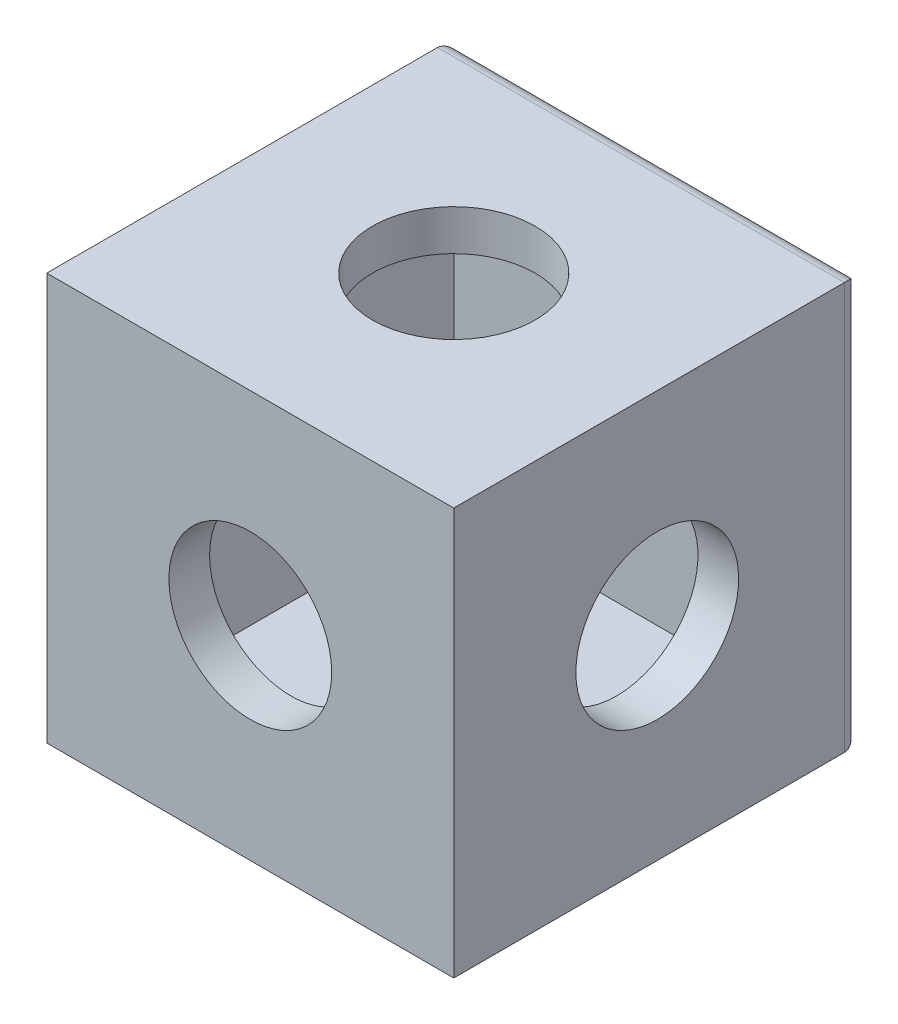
SolidWorks part; units mm, degrees
ref_plane "Alzado" through (0, 0, 0) normal (0, 0, 1) x (1, 0, 0)
ref_plane "Planta" through (0, 0, 0) normal (0, 1, 0) x (1, 0, 0)
ref_plane "Vista lateral" through (0, 0, 0) normal (1, 0, 0) x (0, 0, -1)
sketch "Croquis1" plane through (0, 0, 0) normal (0, 0, 1) x (1, 0, 0)
  line L1 (-62.5, 62.5) -> (62.5, 62.5)
  line L2 (-62.5, 62.5) -> (-62.5, -62.5)
  line L3 (-62.5, -62.5) -> (62.5, -62.5)
  line L4 (62.5, 62.5) -> (62.5, -62.5)
  line L5 (-62.5, 62.5) -> (62.5, -62.5) construction
  line L6 (-62.5, -62.5) -> (62.5, 62.5) construction
  line L7 (-50, 50) -> (50, 50)
  line L8 (-50, 50) -> (-50, -50)
  line L9 (-50, -50) -> (50, -50)
  line L10 (50, 50) -> (50, -50)
  line L11 (-50, 50) -> (50, -50) construction
  line L12 (-50, -50) -> (50, 50) construction
  point P0 (0, 0)
  point P6 (0, 0)
  dimension "D1" = 125
  dimension "D2" = 125
  dimension "D3" = 100
extrude "Saliente-Extruir1" add sketch "Croquis1" along normal blind 125
sketch "Croquis2" plane through (0, 0, 0) normal (0, 0, -1) x (-1, 0, 0)
  line L1 (-50, 50) -> (50, 50)
  line L2 (-50, 50) -> (-50, -50)
  line L3 (-50, -50) -> (50, -50)
  line L4 (50, 50) -> (50, -50)
  line L5 (-50, 50) -> (50, -50) construction
  line L6 (-50, -50) -> (50, 50) construction
  point P0 (0, 0)
extrude "Saliente-Extruir2" add sketch "Croquis2" against normal blind 12.5
sketch "Croquis3" plane through (-62.5, 0, 0) normal (-1, 0, 0) x (0, 0, 1)
  line L0 (0, 62.5) -> (0, -62.5) construction
  line L1 (125, 62.5) -> (0, 62.5) construction
  circle A0 centre (62.5, 0) radius 25
  dimension "D1" = 62.5
  dimension "D2" = 62.5
extrude "Cortar-Extruir1" cut sketch "Croquis3" against normal blind 187.5
sketch "Croquis4" plane through (0, 62.5, 0) normal (0, 1, 0) x (1, 0, 0)
  line L0 (62.5, -125) -> (62.5, 0) construction
  line L1 (62.5, 0) -> (-62.5, 0) construction
  circle A0 centre (0, -62.5) radius 25
  dimension "D1" = 50
  dimension "D2" = 62.5
  dimension "D3" = 62.5
extrude "Cortar-Extruir2" cut sketch "Croquis4" against normal blind 187.5
ref_plane "Plano1" through (62.5, -62.5, 125) normal (1, 0, 0) x (0, 0, -1)
sketch "Croquis6" plane through (0, 0, 125) normal (0, 0, 1) x (1, 0, 0)
  line L1 (-50, 50) -> (50, 50)
  line L2 (-50, 50) -> (-50, -50)
  line L3 (-50, -50) -> (50, -50)
  line L4 (50, 50) -> (50, -50)
  line L5 (-50, 50) -> (50, -50) construction
  line L6 (-50, -50) -> (50, 50) construction
  point P0 (0, 0)
extrude "Saliente-Extruir3" add sketch "Croquis6" against normal blind 12.5
sketch "Croquis7" plane through (0, 0, 125) normal (0, 0, 1) x (1, 0, 0)
  circle A0 centre (0, 0) radius 25
  dimension "D1" = 50
extrude "Cortar-Extruir3" cut sketch "Croquis7" against normal blind 39.5
fillet "Redondeo1" radius 5 4 edges at (-62.5, 0, 0) (0, -62.5, 0) (0, 62.5, 0) (62.5, 0, 0)
